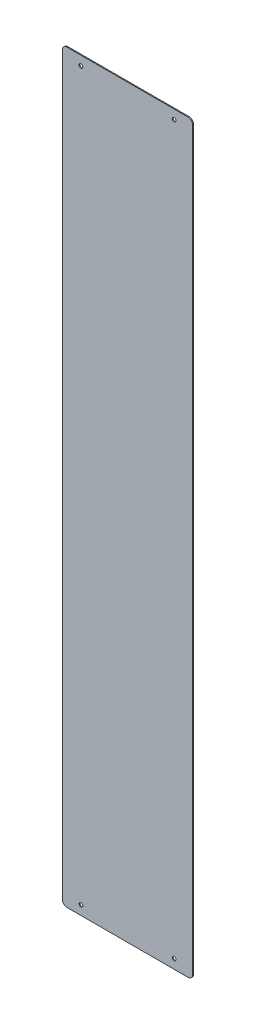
SolidWorks part; units mm, degrees
ref_plane "Front Plane" through (0, 0, 0) normal (0, 0, 1) x (1, 0, 0)
ref_plane "Top Plane" through (0, 0, 0) normal (0, 1, 0) x (1, 0, 0)
ref_plane "Right Plane" through (0, 0, 0) normal (1, 0, 0) x (0, 0, -1)
sketch "Sketch1" plane through (0, 0, 0) normal (0, 0, 1) x (1, 0, 0)
  line L0 (0, 0) -> (-70, 0) construction
  line L1 (65, -400) -> (-65, -400)
  line L2 (70, -395) -> (70, 395)
  line L3 (65, 400) -> (-65, 400)
  line L4 (-70, -395) -> (-70, 395)
  line L5 (70, -400) -> (-70, 400) construction
  line L6 (70, 400) -> (-70, -400) construction
  line L7 (0, 0) -> (0, 400) construction
  circle A0 centre (-50, 390) radius 2
  arc A1 (-65, -400) -> (-70, -395) centre (-65, -395) cw
  arc A2 (65, -400) -> (70, -395) centre (65, -395) ccw
  arc A3 (70, 395) -> (65, 400) centre (65, 395) ccw
  arc A4 (-65, 400) -> (-70, 395) centre (-65, 395) ccw
  circle A5 centre (50, 390) radius 2
  circle A6 centre (50, -390) radius 2
  circle A7 centre (-50, -390) radius 2
  point P0 (0, 0)
  dimension "D3" = 4
  dimension "D5" = 20
  dimension "D6" = 5
  dimension "D1" = 800
  dimension "D2" = 140
  dimension "D4" = 10
extrude "Boss-Extrude1" add sketch "Sketch1" along normal blind 1
